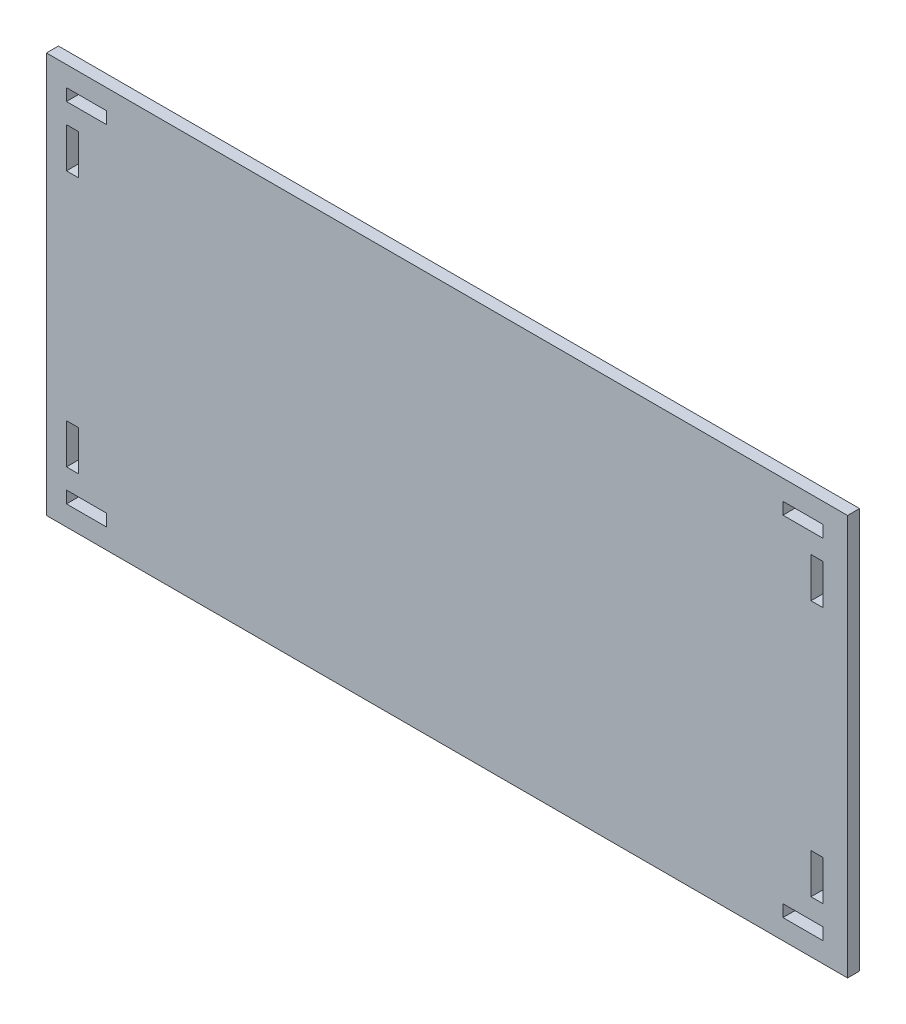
SolidWorks part; units mm, degrees
ref_plane "Plano frontal" through (0, 0, 0) normal (0, 0, 1) x (1, 0, 0)
ref_plane "Plano superior" through (0, 0, 0) normal (0, 1, 0) x (1, 0, 0)
ref_plane "Plano direito" through (0, 0, 0) normal (1, 0, 0) x (0, 0, -1)
sketch "Esboço1" plane through (0, 0, 0) normal (0, 0, 1) x (1, 0, 0)
  line L0 (-43.5682, -22.671) -> (156.4318, -22.671)
  line L1 (-43.5682, -22.671) -> (-43.5682, 77.329)
  line L2 (-43.5682, 77.329) -> (156.4318, 77.329)
  line L3 (156.4318, 77.329) -> (156.4318, -22.671)
  line L11 (-38.5682, -17.671) -> (-28.5682, -17.671)
  line L12 (-38.5682, 72.329) -> (-28.5682, 72.329)
  line L13 (-28.5682, 72.329) -> (-28.5682, 69.329)
  line L14 (-28.5682, 69.329) -> (-38.5682, 69.329)
  line L15 (-38.5682, 69.329) -> (-38.5682, 72.329)
  line L16 (150.3037, 72.329) -> (150.3037, 69.329)
  line L17 (150.3037, 69.329) -> (140.3037, 69.329)
  line L18 (140.3037, 69.329) -> (140.3037, 72.329)
  line L19 (140.3037, 72.329) -> (150.3037, 72.329)
  line L21 (150.3037, -17.671) -> (140.3037, -17.671)
  line L22 (140.3037, -17.671) -> (140.3037, -14.671)
  line L23 (140.3037, -14.671) -> (150.3037, -14.671)
  line L24 (150.3037, -14.671) -> (150.3037, -17.671)
  line L25 (-28.5682, -17.671) -> (-28.5682, -14.671)
  line L26 (-28.5682, -14.671) -> (-38.5682, -14.671)
  line L27 (-38.5682, -14.671) -> (-38.5682, -17.671)
  line L30 (-38.5682, -9.671) -> (-35.5682, -9.671)
  line L31 (-35.5682, -9.671) -> (-35.5682, 0.329)
  line L32 (-35.5682, 0.329) -> (-38.5682, 0.329)
  line L33 (-38.5682, 0.329) -> (-38.5682, -9.671)
  line L34 (150.3037, 64.329) -> (150.3037, 54.329)
  line L35 (-38.5682, 64.329) -> (-35.5682, 64.329)
  line L36 (-35.5682, 64.329) -> (-35.5682, 54.329)
  line L37 (-35.5682, 54.329) -> (-38.5682, 54.329)
  line L38 (-38.5682, 54.329) -> (-38.5682, 64.329)
  line L39 (150.3037, 54.329) -> (147.3037, 54.329)
  line L40 (147.3037, 54.329) -> (147.3037, 64.329)
  line L41 (147.3037, 64.329) -> (150.3037, 64.329)
  line L42 (150.3037, -9.671) -> (150.3037, 0.329)
  line L43 (150.3037, 0.329) -> (147.3037, 0.329)
  line L44 (147.3037, 0.329) -> (147.3037, -9.671)
  line L45 (147.3037, -9.671) -> (150.3037, -9.671)
extrude "Ressalto-extrusão2" add sketch "Esboço1" along normal blind 3
